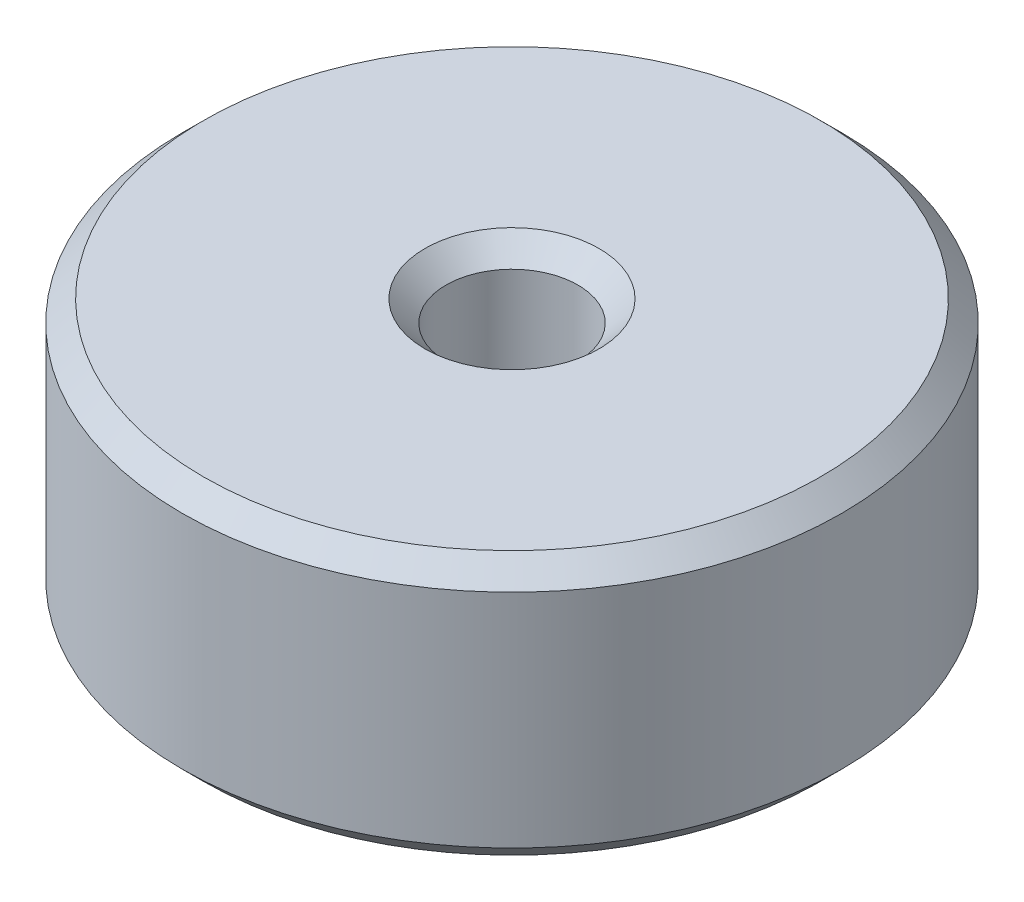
SolidWorks part; units mm, degrees
ref_plane "Front" through (0, 0, 0) normal (0, 0, 1) x (1, 0, 0)
ref_plane "Top" through (0, 0, 0) normal (0, 1, 0) x (1, 0, 0)
ref_plane "Right" through (0, 0, 0) normal (1, 0, 0) x (0, 0, -1)
sketch "Sketch1" plane through (0, 0, 0) normal (0, 1, 0) x (1, 0, 0)
  circle A0 centre (0, 0) radius 0.7937
  circle A1 centre (0, 0) radius 3.9688
  dimension "D1" = 1.5875
  dimension "D2" = 7.9375
extrude "Boss-Extrude1" add sketch "Sketch1" along normal blind 3.175
chamfer "Chamfer1" distance 0.254 angle 45 4 edges at (0, 0, 0.7937) (0, 0, 3.9688) (0, 3.175, 0.7937) (0, 3.175, 3.9688)
